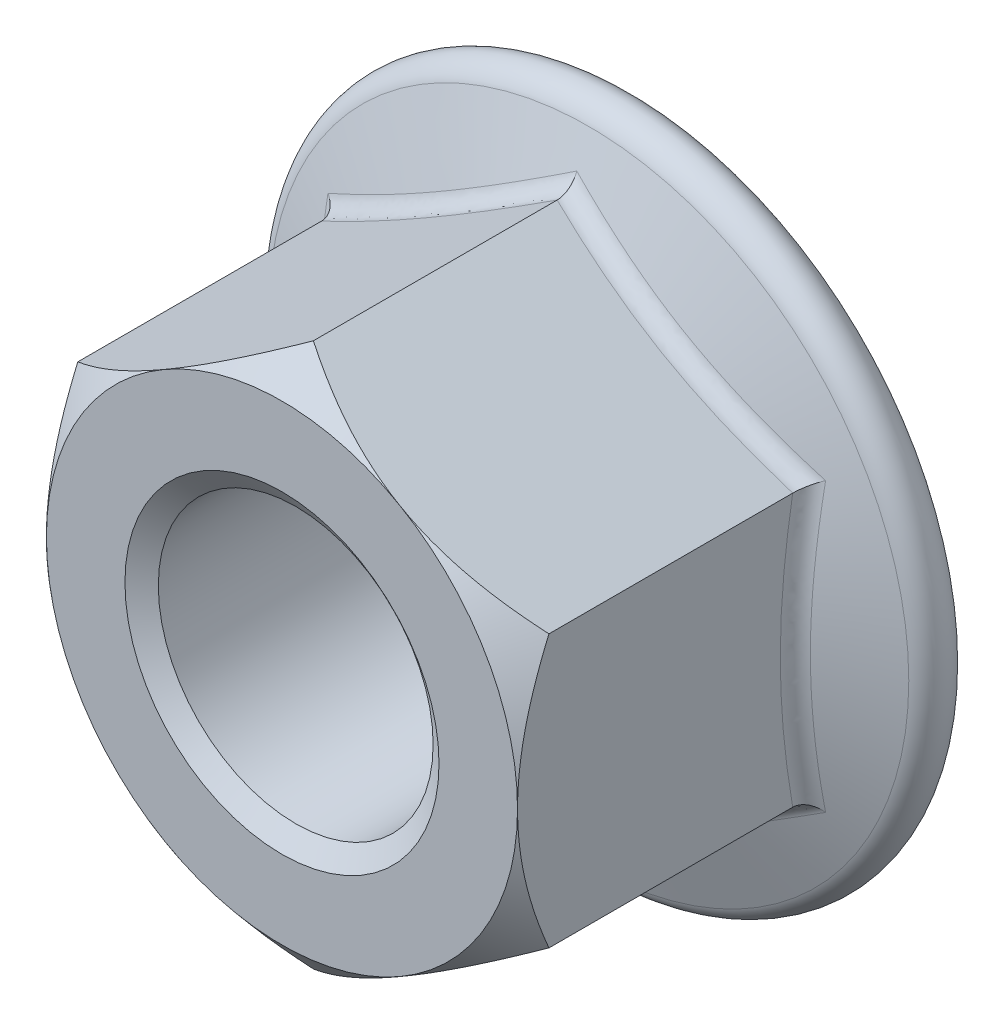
SolidWorks part; units mm, degrees
extrude "BaseNut" add sketch "BaseNutSke" against normal blind 22.5298
sketch "BaseNutSke" plane through (0, 0, 0) normal (0, 0, 1) x (1, 0, 0)
  line L6 (15, 8.6603) -> (15, -8.6603)
  line L7 (-15, 8.6603) -> (-15, -8.6603)
  line L8 (15, 8.6603) -> (0, 17.3205)
  line L9 (0, 17.3205) -> (-15, 8.6603)
  line L10 (-15, -8.6603) -> (0, -17.3205)
  line L11 (0, -17.3205) -> (15, -8.6603)
  circle A0 centre (0, 0) radius 8.75
pattern_linear "ThdSchPat" [suppressed]
revolve "ThreadSchematic" cut sketch "ThdSchSke" angle 360 about L6
sketch "ThdSchSke" plane through (0, 0, 0) normal (0, 1, 0) x (1, 0, 0)
  line L0 (-10, 0.0254) -> (-8.75, 0.9007)
  line L1 (-8.75, 0.9007) -> (-4.375, 0.9007)
  line L2 (-4.375, 0.9007) -> (-4.375, -0.8499)
  line L3 (-4.375, -0.8499) -> (-8.75, -0.8499)
  line L4 (-8.75, -0.8499) -> (-10, 0.0254)
  line L5 (-3.175, 3.175) -> (3.175, 3.175) construction
  line L6 (0, 3.175) -> (0, -2.9874) construction
  line L7 (0, 21.6291) -> (0, 0.8753) construction
ref_plane "Plane1" through (0, 0, 0) normal (0, 0, 1) x (1, 0, 0)
ref_plane "Plane2" through (0, 0, 0) normal (0, 1, 0) x (1, 0, 0)
ref_plane "Plane3" through (0, 0, 0) normal (1, 0, 0) x (0, 0, -1)
other "Configuration Table"
sketch "Sketch6" plane through (0, 0, 0) normal (1, 0, 0) x (0, 0, -1)
  line L0 (15.296, 8.75) -> (19.5298, 20.3823)
  line L1 (22.5298, 8.75) -> (22.5298, 19.8534)
  line L2 (19.5298, 32.2909) -> (19.5298, 20.3823) construction
  line L3 (23.7075, 21.4) -> (19.5103, 21.4) construction
  line L4 (22.5298, 8.75) -> (15.296, 8.75)
  line L5 (23.7075, -21.4) -> (19.5103, -21.4) construction
  line L6 (22.5298, 8.6603) -> (22.5298, 17.3205) construction
  line L7 (0, 0) -> (32.9582, 0) construction
  line L8 (22.5298, -8.75) -> (15.296, -8.75) construction
  line L9 (22.5298, 0) -> (0, 0) construction
  arc A0 (22.5298, 19.8534) -> (19.5298, 20.3823) centre (20.9832, 19.8534) ccw
revolve "Flange" add sketch "Sketch6" angle 360 about L7
sketch "Sketch3" plane through (0, 0, 0) normal (1, 0, 0) x (0, 0, -1)
  line L0 (22.5298, 15) -> (20.5298, 17.3205) construction
  line L1 (20.5298, 17.3205) -> (20.5298, 30.0205) construction
  line L2 (20.5298, 30.0205) -> (35.2298, 30.0205) construction
  line L3 (35.2298, 30.0205) -> (35.2298, 15) construction
  line L4 (35.2298, 15) -> (22.5298, 15) construction
  line L5 (22.5298, 8.6603) -> (22.5298, 17.3205) construction
  line L6 (18.4154, 17.3205) -> (0, 17.3205) construction
  line L7 (0, 0) -> (38.6776, 0) construction
  line L8 (22.5298, 0) -> (0, 0) construction
  line L9 (11.2649, 17.3205) -> (11.2649, 44.222) construction
  line L10 (2, 30.0205) -> (-12.7, 30.0205)
  line L11 (-12.7, 30.0205) -> (-12.7, 15)
  line L12 (-12.7, 15) -> (0, 15)
  line L13 (0, 15) -> (2, 17.3205)
  line L14 (2, 17.3205) -> (2, 30.0205)
  line L16 (18.4154, 17.3205) -> (0, 17.3205) construction
revolve "Double-Chamfer" cut sketch "Sketch3" angle 360 about L7
fillet "FlangeFillet" radius 1.2 6 edges
sketch "Sketch5" plane through (0, 0, 0) normal (1, 0, 0) x (0, 0, -1)
  line L0 (22.5044, 10) -> (21.5416, 8.625)
  line L1 (22.5552, 10) -> (22.5044, 10)
  line L2 (22.5552, 10) -> (22.5552, 8.625)
  line L3 (22.5552, 8.625) -> (21.5416, 8.625)
  line L6 (-0.0508, 10) -> (0, 10)
  line L7 (0, 10) -> (0.9628, 8.625)
  line L9 (0.9628, 8.625) -> (-0.0508, 8.625)
  line L10 (-0.0508, 8.625) -> (-0.0508, 10)
  line L11 (25.0375, 0) -> (38.388, 0) construction
  line L12 (22.5298, 0) -> (0, 0) construction
revolve "EndChamfer" cut sketch "Sketch5" angle 360 about L11
equation "\"D2@BaseNutSke\" = \"Width_flats@BaseNutSke\" / 2"
equation "\"D3@BaseNutSke\" = \"Width_flats@BaseNutSke\" / 2"
equation "\"D1@Sketch3\" = \"Width_flats@BaseNutSke\" /2"
equation "\"D2@Sketch3\" = \"Thread_major@ThreadCosmetic\" *.1"
equation "\"D4@BaseNutSke\" = \"D3@BaseNutSke\""
equation "\"Thread_major@ThdSchSke\" = \"Thread_major@ThreadCosmetic\""
equation "\"Tap_Drill@ThdSchSke\" = \"Tap_drill@BaseNutSke\""
equation "\"OverCut@ThdSchSke\" = \"Tap_Drill@ThdSchSke\" * 0.5"
equation "\"Num_threads@ThdSchPat\" = int(  ( \"Thickness@BaseNut\" - 0.0508 ) / \"Advance@ThdSchSke\" + 0.999 )  + 1"
equation "\"Advance@ThdSchPat\" = ( \"Thickness@BaseNut\" - 0.0508 ) /  (\"Num_threads@ThdSchPat\" - 1) 'relax it"
equation "' \"Num_threads@ThdSchPat\" = \"Num_threads@ThdSchPat\" - sgn( \"Num_threads@ThdSchPat\" - 1) '---chamfered tips only---"
equation "\"ThreadMajor@Sketch5\" = \"Thread_major@ThreadCosmetic\" * 0.5"
equation "\"ChamferDepth@Sketch5\" = (\"Thread_major@ThreadCosmetic\" - \"Tap_drill@BaseNutSke\") * 0.55"
equation "\"Offset1@Sketch5\" = \"Thickness@BaseNut\" + 0.0254"
equation "\"Offset2@Sketch5\" = \"Offset1@Sketch5\" + 0.0508"
equation "\"D1@Sketch6\" = \"Tap_drill@BaseNutSke\""
equation "\"D5@Sketch3\" = \"Thickness@BaseNut\" / 2"
